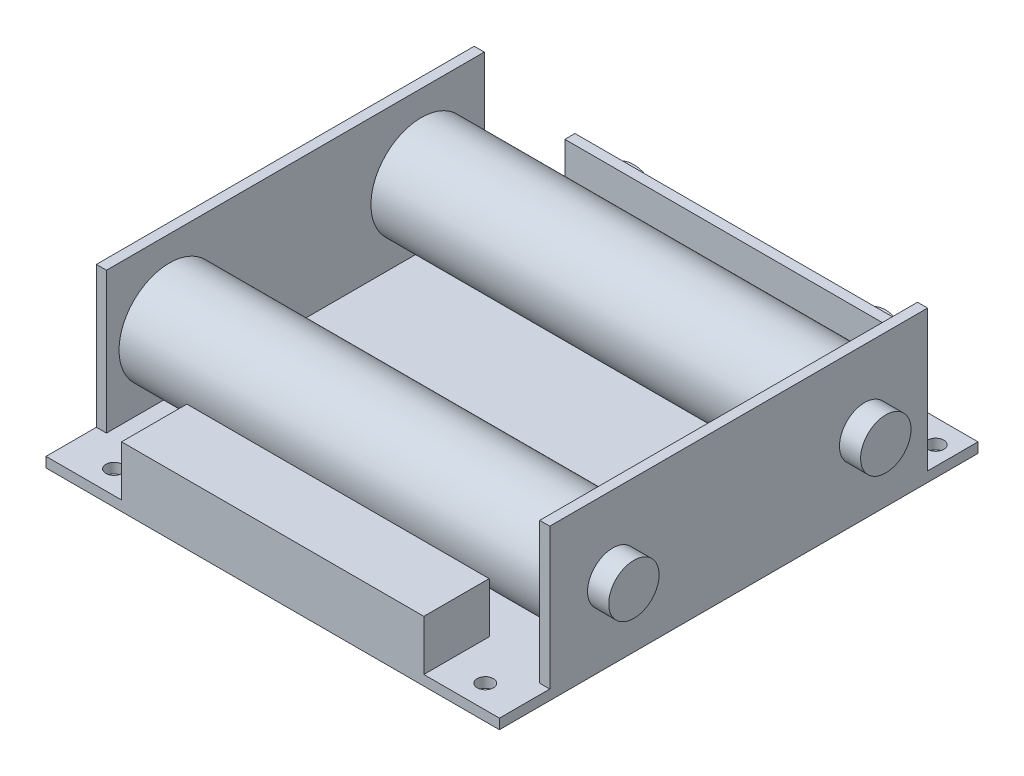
SolidWorks part; units mm, degrees
ref_plane "Front Plane" through (0, 0, 0) normal (0, 0, 1) x (1, 0, 0)
ref_plane "Top Plane" through (0, 0, 0) normal (0, 1, 0) x (1, 0, 0)
ref_plane "Right Plane" through (0, 0, 0) normal (1, 0, 0) x (0, 0, -1)
sketch "Sketch1" plane through (0, 0, 0) normal (0, 1, 0) x (1, 0, 0)
  line L1 (45, 47.5) -> (-45, 47.5)
  line L2 (45, 47.5) -> (45, -47.5)
  line L3 (45, -47.5) -> (-45, -47.5)
  line L4 (-45, 47.5) -> (-45, -47.5)
  line L5 (45, 47.5) -> (-45, -47.5) construction
  line L6 (45, -47.5) -> (-45, 47.5) construction
  point P0 (0, 0)
  dimension "D1" = 90
  dimension "D2" = 95
extrude "Boss-Extrude1" add sketch "Sketch1" along normal blind 2
hole_wizard "Ø3.2 (3.2) Diameter Hole1" positions "Sketch3" profile "Sketch2" hole size "Ø3.2" standard "ISO"
sketch "Sketch3" plane through (0, 0, 0) normal (0, -1, 0) x (-1, 0, 0)
  line L0 (45, 47.5) -> (45, -47.5) construction
  line L2 (45, -47.5) -> (-45, -47.5) construction
  line L3 (-45, -47.5) -> (-45, 47.5) construction
  line L4 (-45, 47.5) -> (45, 47.5) construction
  point P0 (36.1, -42.9)
  point P2 (-37.6, -42.9)
  point P4 (-41.3, 42.8)
  point P6 (38.7, 42.8)
  dimension "D1" = 8.9
  dimension "D2" = 4.6
  dimension "D3" = 7.4
  dimension "D4" = 4.6
  dimension "D5" = 4.7
  dimension "D6" = 3.7
  dimension "D7" = 4.7
  dimension "D8" = 6.3
sketch "Sketch2" plane through (-36.1, 0, 42.9) normal (1, 0, 0) x (0, 0, -1)
  line L0 (0, 0) -> (0, 2)
  line L1 (0, 2) -> (1.6, 2)
  line L2 (1.6, 2) -> (1.6, 0)
  line L5 (1.6, 0) -> (0, 0)
  line L11 (0, -6.35) -> (0, 107.95) construction
  dimension "Thru Hole Dia." = 3.2
  dimension "Thru Hole Depth" = 2
sketch "Sketch4" plane through (45, 0, 0) normal (1, 0, 0) x (0, 0, -1)
  line L0 (-47.5, 0) -> (47.5, 0) construction
  line L1 (-37.5, 0) -> (37.5, 0)
  line L2 (-37.5, 0) -> (-37.5, 30)
  line L3 (-37.5, 30) -> (37.5, 30)
  line L4 (37.5, 0) -> (37.5, 30)
  line L5 (-47.5, 2) -> (-47.5, 0) construction
  line L6 (47.5, 2) -> (47.5, 0) construction
  point P6 (-47.5, 1)
  dimension "D1" = 10
  dimension "D2" = 10
  dimension "D3" = 30
extrude "Boss-Extrude2" add sketch "Sketch4" against normal blind 2
mirror "Mirror1" about plane through (0, 0, 0) normal (1, 0, 0) of "Boss-Extrude2"
sketch "Sketch5" plane through (45, 0, 0) normal (1, 0, 0) x (0, 0, -1)
  line L0 (47.5, 2) -> (47.5, 0) construction
  line L2 (37.5, 30) -> (-37.5, 30) construction
  circle A0 centre (-25, 15) radius 5
  circle A1 centre (25, 15) radius 5
  point P4 (47.5, 1)
  dimension "D1" = 10
  dimension "D2" = 10
  dimension "D3" = 50
  dimension "D4" = 22.5
  dimension "D5" = 15
extrude "Boss-Extrude3" add sketch "Sketch5" along normal blind 4.2 and the other way blind 94.2
surface "Surface-Offset1" parameters "D1"=5
sketch "Sketch6" plane through (0, 2, 0) normal (0, 1, 0) x (1, 0, 0)
  line L0 (-45, -47.5) -> (45, -47.5) construction
  line L1 (-30, -34.5) -> (30, -34.5)
  line L2 (-30, -34.5) -> (-30, -47.5)
  line L3 (-30, -47.5) -> (30, -47.5)
  line L4 (30, -34.5) -> (30, -47.5)
  line L5 (-45, -37.5) -> (-45, -47.5) construction
  line L6 (45, -47.5) -> (45, -37.5) construction
  dimension "D1" = 15
  dimension "D2" = 15
  dimension "D3" = 13
extrude "Boss-Extrude4" add sketch "Sketch6" along normal blind 10
sketch "Sketch7" plane through (0, 0, -47.5) normal (0, 0, -1) x (-1, 0, 0)
  line L0 (-45, 0) -> (45, 0) construction
  line L1 (-35, 0) -> (35, 0)
  line L2 (-35, 0) -> (-35, 15)
  line L3 (-35, 15) -> (35, 15)
  line L4 (35, 0) -> (35, 15)
  line L5 (-45, 2) -> (-45, 0) construction
  line L6 (45, 2) -> (45, 0) construction
  point P6 (-45, 1)
  dimension "D1" = 10
  dimension "D2" = 10
  dimension "D3" = 15
extrude "Boss-Extrude5" add sketch "Sketch7" against normal blind 2
sketch "Sketch8" plane through (0, 0, -47.5) normal (0, 0, -1) x (-1, 0, 0)
  line L1 (-45, 0) -> (45, 0) construction
  line L2 (-35, 15) -> (-35, 2) construction
  line L3 (35, 2) -> (35, 15) construction
  circle A0 centre (-22.45, 6.3) radius 5
  circle A1 centre (27.55, 6.3) radius 5
  point P6 (-35, 8.5)
  dimension "D1" = 10
  dimension "D2" = 10
  dimension "D3" = 6.3
  dimension "D4" = 12.55
  dimension "D5" = 7.45
extrude "Boss-Extrude6" add sketch "Sketch8" along normal blind 4.2
